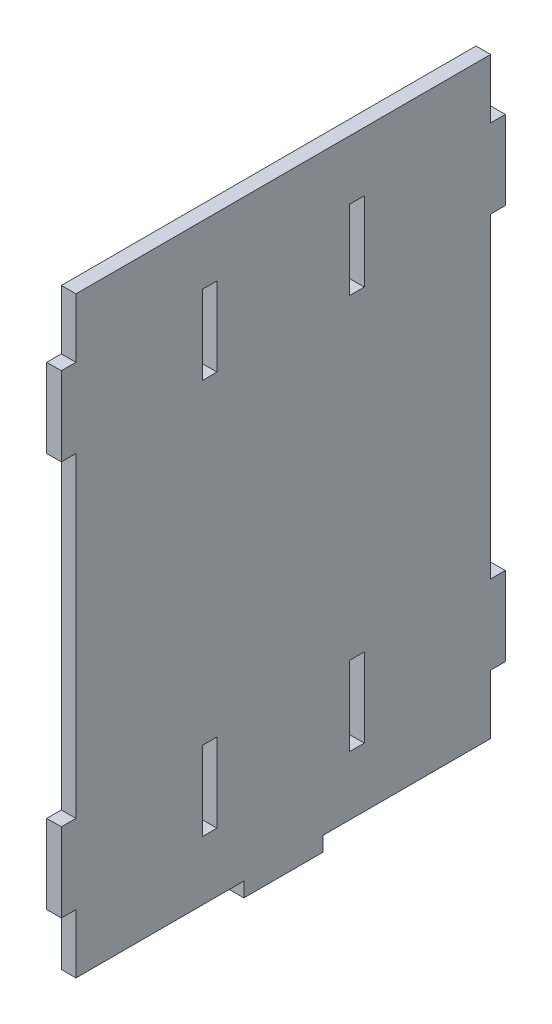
SolidWorks part; units mm, degrees
ref_plane "Front Plane" through (0, 0, 0) normal (0, 0, 1) x (1, 0, 0)
ref_plane "Top Plane" through (0, 0, 0) normal (0, 1, 0) x (1, 0, 0)
ref_plane "Right Plane" through (0, 0, 0) normal (1, 0, 0) x (0, 0, -1)
sketch "Sketch1" plane through (0, 0, 0) normal (1, 0, 0) x (0, 0, -1)
  line L0 (52.5, 135) -> (56.2, 135)
  line L1 (-10, 0) -> (10, 0) construction
  line L2 (-52.5, 0) -> (-52.5, 15)
  line L3 (-52.5, 150) -> (52.5, 150)
  line L4 (52.5, 0) -> (52.5, 15)
  line L5 (-56.2, 135) -> (-52.5, 135)
  line L6 (-56.2, 135) -> (-56.2, 115)
  line L7 (-56.2, 115) -> (-52.5, 115)
  line L8 (56.2, 135) -> (56.2, 115)
  line L9 (-56.2, 35) -> (-52.5, 35)
  line L10 (-56.2, 35) -> (-56.2, 15)
  line L11 (-56.2, 15) -> (-52.5, 15)
  line L12 (56.2, 35) -> (56.2, 15)
  line L13 (52.5, 115) -> (56.2, 115)
  line L14 (52.5, 135) -> (52.5, 150)
  line L15 (-52.5, 135) -> (-52.5, 150)
  line L16 (-52.5, 35) -> (-52.5, 115)
  line L17 (52.5, 35) -> (56.2, 35)
  line L18 (52.5, 15) -> (56.2, 15)
  line L19 (52.5, 35) -> (52.5, 115)
  line L20 (-16.8, 115) -> (16.8, 115) construction
  line L21 (-20.5, 135) -> (-16.8, 135)
  line L22 (-20.5, 135) -> (-20.5, 115)
  line L23 (-20.5, 115) -> (-16.8, 115)
  line L24 (-16.8, 135) -> (-16.8, 115)
  line L25 (20.5, 135) -> (16.8, 135)
  line L26 (20.5, 135) -> (20.5, 115)
  line L27 (20.5, 115) -> (16.8, 115)
  line L28 (16.8, 135) -> (16.8, 115)
  line L29 (-20.5, 35) -> (-16.8, 35)
  line L30 (-20.5, 35) -> (-20.5, 15)
  line L31 (-20.5, 15) -> (-16.8, 15)
  line L32 (-16.8, 35) -> (-16.8, 15)
  line L33 (16.8, 35) -> (20.5, 35)
  line L34 (16.8, 35) -> (16.8, 15)
  line L35 (16.8, 15) -> (20.5, 15)
  line L36 (20.5, 35) -> (20.5, 15)
  line L37 (0, 115) -> (0, 150) construction
  line L38 (10, 0) -> (52.5, 0)
  line L39 (-10, 0) -> (-52.5, 0)
  line L40 (-10, 0) -> (-10, -3.7)
  line L41 (-10, -3.7) -> (10, -3.7)
  line L42 (10, 0) -> (10, -3.7)
  dimension "D10" = 3.7
  dimension "D1" = 105
  dimension "D2" = 3.7
  dimension "D3" = 20
  dimension "D4" = 150
  dimension "D5" = 15
  dimension "D6" = 15
  dimension "D7" = 3.7
  dimension "D8" = 32
  dimension "D9" = 112.4
  dimension "D11" = 20
extrude "Extrude1" add sketch "Sketch1" along normal blind 3.7
